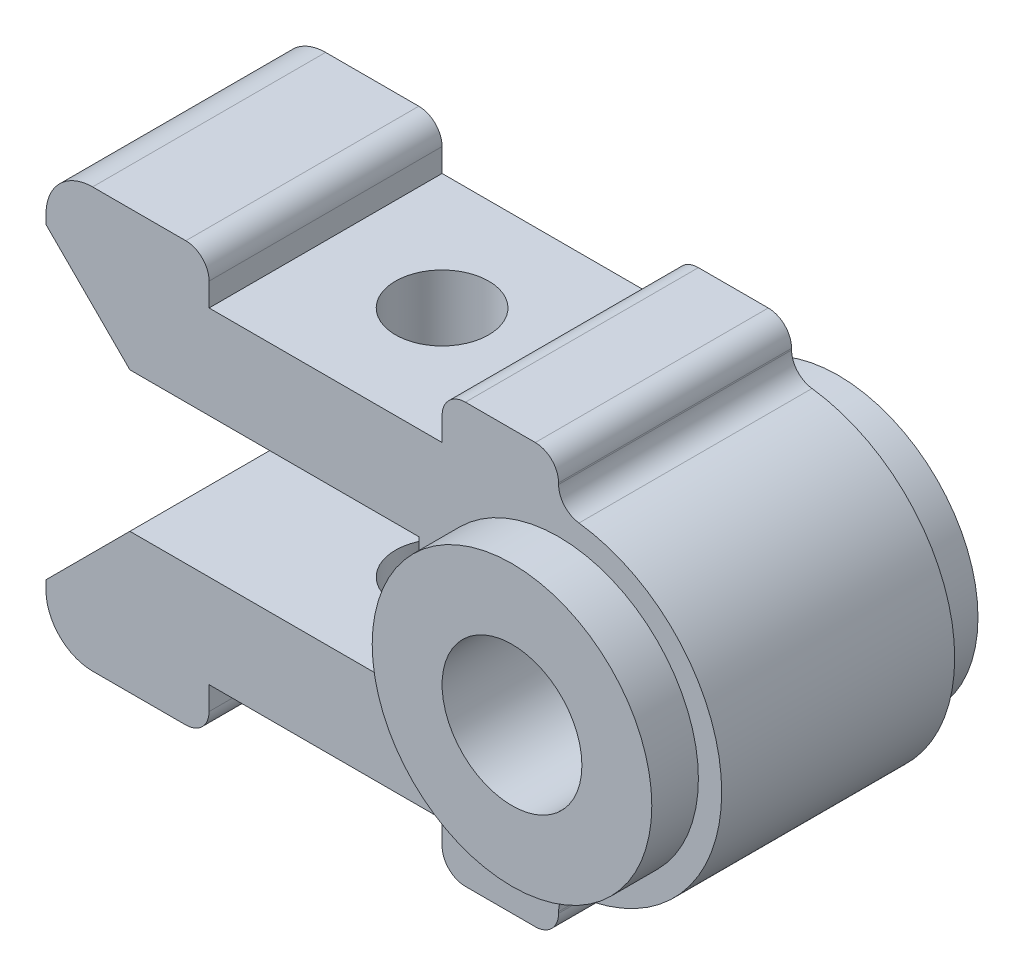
SolidWorks part; units mm, degrees
ref_plane "前视基准面" through (0, 0, 0) normal (0, 0, 1) x (1, 0, 0)
ref_plane "上视基准面" through (0, 0, 0) normal (0, 1, 0) x (1, 0, 0)
ref_plane "右视基准面" through (0, 0, 0) normal (1, 0, 0) x (0, 0, -1)
sketch "草图1" plane through (0, 0, 0) normal (0, 0, 1) x (1, 0, 0)
  line L0 (-5.5, 3.3) -> (-3.7, 1.5)
  line L1 (5.5, 4.5) -> (-5.5, 4.5)
  line L2 (5.5, 4.5) -> (5.5, -4.5)
  line L3 (5.5, -4.5) -> (-5.5, -4.5)
  line L4 (-5.5, 4.5) -> (-5.5, -4.5)
  line L5 (5.5, 4.5) -> (-5.5, -4.5) construction
  line L6 (5.5, -4.5) -> (-5.5, 4.5) construction
  line L7 (-3.7, 1.5) -> (5.5, 1.5)
  line L8 (0, 0) -> (5.5, 0) construction
  line L9 (-3.7, -1.5) -> (5.5, -1.5)
  line L10 (-5.5, -3.3) -> (-3.7, -1.5)
  line L11 (2.5, 1.5) -> (2.5, -1.5)
  arc A0 (5.5, -3.5) -> (5.5, 3.5) centre (5.5, 0) ccw
  circle A1 centre (5.5, 0) radius 1.5
  point P0 (0, 0)
  dimension "D2" = 7
  dimension "D1" = 9
  dimension "D3" = 11
  dimension "D4" = 1.2
  dimension "D5" = 135
  dimension "D6" = 3
  dimension "D7" = 3
extrude "凸台-拉伸1" add sketch "草图1" along normal mid plane 5 contours L0 L7 L2 L1 L4 | L10 L4 L3 L2 L9 | A1 L2 A0 | A1 L7 L11 L9
fillet "圆角1" radius 1 2 edges at (-5.5, -4.5, 0) (-5.5, 4.5, 0)
sketch "草图2" plane through (0, 0, 2.5) normal (0, 0, 1) x (1, 0, 0)
  line L0 (5.5, 4.5) -> (-4.5, 4.5) construction
  line L1 (-2, 4.5) -> (3, 4.5)
  line L2 (-2, 4.5) -> (-2, 3.5)
  line L3 (-2, 3.5) -> (3, 3.5)
  line L4 (3, 4.5) -> (3, 3.5)
  line L5 (5.5, -4.5) -> (-4.5, -4.5) construction
  line L6 (-2, -4.5) -> (3, -4.5)
  line L7 (-2, -4.5) -> (-2, -3.5)
  line L8 (-2, -3.5) -> (3, -3.5)
  line L9 (3, -4.5) -> (3, -3.5)
  dimension "D1" = 1
  dimension "D2" = 5
  dimension "D3" = 5
  dimension "D4" = 1
  dimension "D5" = 2
  dimension "D6" = 2
extrude "切除-拉伸1" cut sketch "草图2" against normal blind 5
sketch "草图4" plane through (0, -3.5, 0) normal (0, -1, 0) x (1, 0, 0)
  line L0 (-2, -2.5) -> (-2, 2.5) construction
  line L1 (3, 2.5) -> (-2, 2.5) construction
  circle A0 centre (0.5, 0) radius 1
  dimension "D1" = 2
  dimension "D2" = 2.5
  dimension "D3" = 2.5
extrude "切除-拉伸2" cut sketch "草图4" against normal through all both and the other way through all
fillet "圆角2" radius 0.5 8 edges at (5.5, 3.5, 0) (5.5, -3.5, 0) (-2, 4.5, 0) (3, 4.5, 0) (-2, -4.5, 0) (3, -4.5, 0) (5.5, -4.5, 0) (5.5, 4.5, 0)
sketch "草图5" plane through (0, 0, 2.5) normal (0, 0, 1) x (1, 0, 0)
  circle A0 centre (5.5, 0) radius 3
  circle A1 centre (5.5, 0) radius 1.5
  dimension "D1" = 6
  dimension "D2" = 3
extrude "凸台-拉伸2" add sketch "草图5" along normal blind 1
mirror "镜向1" about plane through (0, 0, 0) normal (0, 0, 1) of "凸台-拉伸2"
